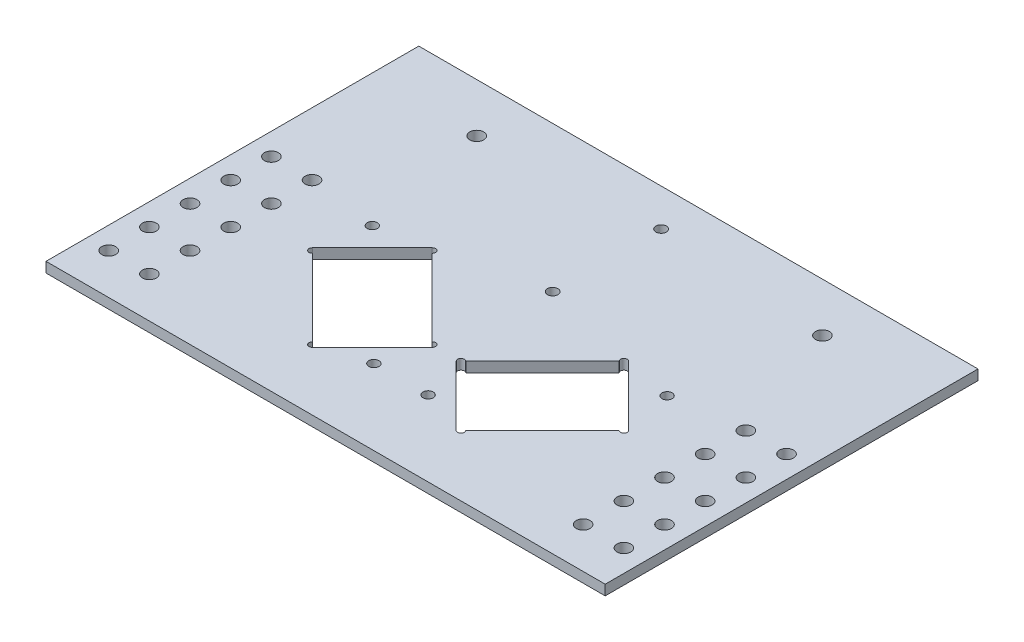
SolidWorks part; units mm, degrees
ref_plane "前视基准面" through (0, 0, 0) normal (0, 0, 1) x (1, 0, 0)
ref_plane "上视基准面" through (0, 0, 0) normal (0, 1, 0) x (1, 0, 0)
ref_plane "右视基准面" through (0, 0, 0) normal (1, 0, 0) x (0, 0, -1)
sketch "草图1" plane through (0, 0, 0) normal (0, 1, 0) x (1, 0, 0)
  line L1 (0, 0) -> (165, 0)
  line L2 (0, 0) -> (0, 110)
  line L3 (0, 110) -> (165, 110)
  line L4 (165, 0) -> (165, 110)
  dimension "D1" = 165
  dimension "D2" = 110
extrude "凸台-拉伸1" add sketch "草图1" along normal blind 3
sketch "草图2" plane through (0, 3, 0) normal (0, 1, 0) x (1, 0, 0)
  line L0 (6.5, 12) -> (18.5, 12) construction
  line L1 (0, 110) -> (0, 0) construction
  line L2 (82.5, 0) -> (82.5, 82.972) construction
  line L3 (0, 0) -> (165, 0) construction
  circle A0 centre (6.5, 12) radius 2.05
  circle A1 centre (18.5, 12) radius 2.05
  circle A2 centre (146.5, 12) radius 2.05
  circle A3 centre (158.5, 12) radius 2.05
  dimension "D2" = 6.5
  dimension "D4" = 4.1
  dimension "D1" = 12
  dimension "D3" = 12
extrude "切除-拉伸1" cut sketch "草图2" against normal through all
pattern_linear "阵列(线性)1" count 5 spacing 12 along (0, 0, -1) of "切除-拉伸1"
sketch "草图4" plane through (0, 3, 0) normal (0, 1, 0) x (1, 0, 0)
  line L0 (78.9645, 34.9952) -> (61.2868, 17.3175) construction
  line L1 (36.5381, 42.0662) -> (61.2868, 17.3175) construction
  line L2 (52.8015, 59.7439) -> (36.5381, 43.4804) construction
  line L3 (54.2157, 59.7439) -> (78.9645, 34.9952) construction
  line L4 (78.9645, 34.9952) -> (61.2868, 17.3175)
  line L5 (35.831, 42.7733) -> (61.2868, 17.3175)
  line L6 (53.5086, 60.451) -> (35.831, 42.7733)
  line L7 (53.5086, 60.451) -> (78.9645, 34.9952)
  line L8 (110.7843, 59.7439) -> (86.0355, 34.9952) construction
  line L9 (128.4619, 43.4804) -> (112.1985, 59.7439) construction
  line L10 (128.4619, 42.0662) -> (103.7132, 17.3175) construction
  line L11 (103.7132, 17.3175) -> (86.0355, 34.9952) construction
  line L12 (111.4914, 60.451) -> (86.0355, 34.9952)
  line L13 (129.169, 42.7733) -> (111.4914, 60.451)
  line L14 (129.169, 42.7733) -> (103.7132, 17.3175)
  line L15 (103.7132, 17.3175) -> (86.0355, 34.9952)
  circle A0 centre (133.5, 95.5937) radius 2.05 construction
  circle A1 centre (82.5, 99) radius 1.55 construction
  circle A2 centre (31.5, 95.5937) radius 2.05 construction
  circle A3 centre (82.5, 67) radius 1.55 construction
  circle A4 centre (133.5, 95.5937) radius 2.05
  circle A5 centre (82.5, 99) radius 1.55
  circle A6 centre (31.5, 95.5937) radius 2.05
  circle A7 centre (82.5, 67) radius 1.55
  circle A8 centre (125.9871, 57.269) radius 1.5 construction
  circle A9 centre (90.5, 22.2464) radius 1.5 construction
  circle A10 centre (74.5, 22.2464) radius 1.5 construction
  circle A11 centre (125.9871, 57.269) radius 1.5
  circle A12 centre (90.5, 22.2464) radius 1.5
  circle A13 centre (74.5, 22.2464) radius 1.5
  circle A14 centre (39.0129, 57.269) radius 1.5 construction
  circle A15 centre (39.0129, 57.269) radius 1.5
  point P33 (115.582, 64.5416)
  point P35 (107.0253, 64.5416)
  point P37 (133.5, 38.8003)
  point P39 (133.1421, 46.7701)
  point P41 (48.8118, 64.9171)
  point P43 (58.49, 65.1478)
  point P45 (31.5, 38.8003)
  point P47 (32.1088, 46.7701)
extrude "切除-拉伸2" cut sketch "草图4" against normal through all
sketch "草图5" plane through (0, 3, 0) normal (0, 1, 0) x (1, 0, 0)
  line L0 (78.9645, 34.9952) -> (53.5086, 60.451) construction
  line L1 (35.831, 42.7733) -> (61.2868, 17.3175) construction
  line L2 (111.4914, 60.451) -> (86.0355, 34.9952) construction
  line L3 (103.7132, 17.3175) -> (129.169, 42.7733) construction
  circle A0 centre (54.2157, 59.7439) radius 1
  circle A1 centre (78.2574, 35.7023) radius 1
  circle A2 centre (60.5797, 18.0246) radius 1
  circle A3 centre (36.5381, 42.0662) radius 1
  circle A4 centre (86.7426, 35.7023) radius 1
  circle A5 centre (104.4203, 18.0246) radius 1
  circle A6 centre (128.4619, 42.0662) radius 1
  circle A7 centre (110.7843, 59.7439) radius 1
  dimension "D1" = 2
extrude "切除-拉伸3" cut sketch "草图5" against normal through all
